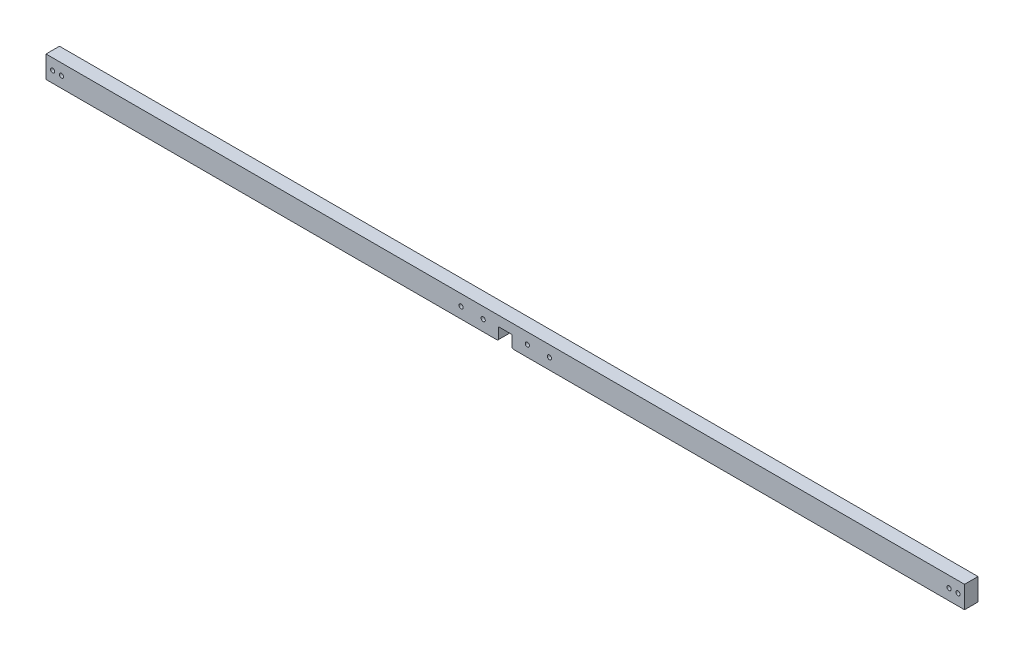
SolidWorks part; units mm, degrees
ref_plane "Front Plane" through (0, 0, 0) normal (0, 0, 1) x (1, 0, 0)
ref_plane "Top Plane" through (0, 0, 0) normal (0, 1, 0) x (1, 0, 0)
ref_plane "Right Plane" through (0, 0, 0) normal (1, 0, 0) x (0, 0, -1)
sketch "Sketch1" plane through (0, 0, 0) normal (0, 0, 1) x (1, 0, 0)
  line L1 (208, -5) -> (-208, -5)
  line L2 (208, -5) -> (208, 5)
  line L3 (208, 5) -> (-208, 5)
  line L4 (-208, -5) -> (-208, 5)
  line L5 (208, -5) -> (-208, 5) construction
  line L6 (208, 5) -> (-208, -5) construction
  point P0 (0, 0)
  dimension "D1" = 10
  dimension "D2" = 416
extrude "Boss-Extrude1" add sketch "Sketch1" along normal mid plane 6.1
sketch "Sketch2" plane through (0, 0, 3.05) normal (0, 0, 1) x (1, 0, 0)
  line L0 (0, 0) -> (208, 0) construction
  line L1 (208, -5) -> (208, 5) construction
  circle A0 centre (10, 0) radius 0.95
  circle A1 centre (20, 0) radius 0.95
  circle A2 centre (205, 0) radius 0.95
  circle A3 centre (201, 0) radius 0.95
  dimension "D4" = 1.9
  dimension "D1" = 10
  dimension "D2" = 10
  dimension "D7" = 3
  dimension "D8" = 7
extrude "Cut-Extrude1" cut sketch "Sketch2" against normal through all
mirror "Mirror1" about plane through (0, 0, 0) normal (1, 0, 0) of "Cut-Extrude1"
sketch "Sketch4" plane through (0, 0, 3.05) normal (0, 0, 1) x (1, 0, 0)
  line L0 (0, 6.6421) -> (0, -8.4324) construction
  line L2 (-3, -12.5622) -> (3, -12.5622)
  line L3 (-3, -12.5622) -> (-3, 0.5)
  line L4 (-3, 0.5) -> (3, 0.5)
  line L5 (3, -12.5622) -> (3, 0.5)
  line L6 (-3, -12.5622) -> (3, 0.5) construction
  line L7 (-3, 0.5) -> (3, -12.5622) construction
  point P3 (0, -6.0311)
  dimension "D1" = 6
  dimension "D2" = 0.5
extrude "Cut-Extrude2" cut sketch "Sketch4" against normal blind 10
chamfer "Chamfer1" distance 0.5 angle 45 2 edges at (3, -5, 0) (-3, -5, 0)
